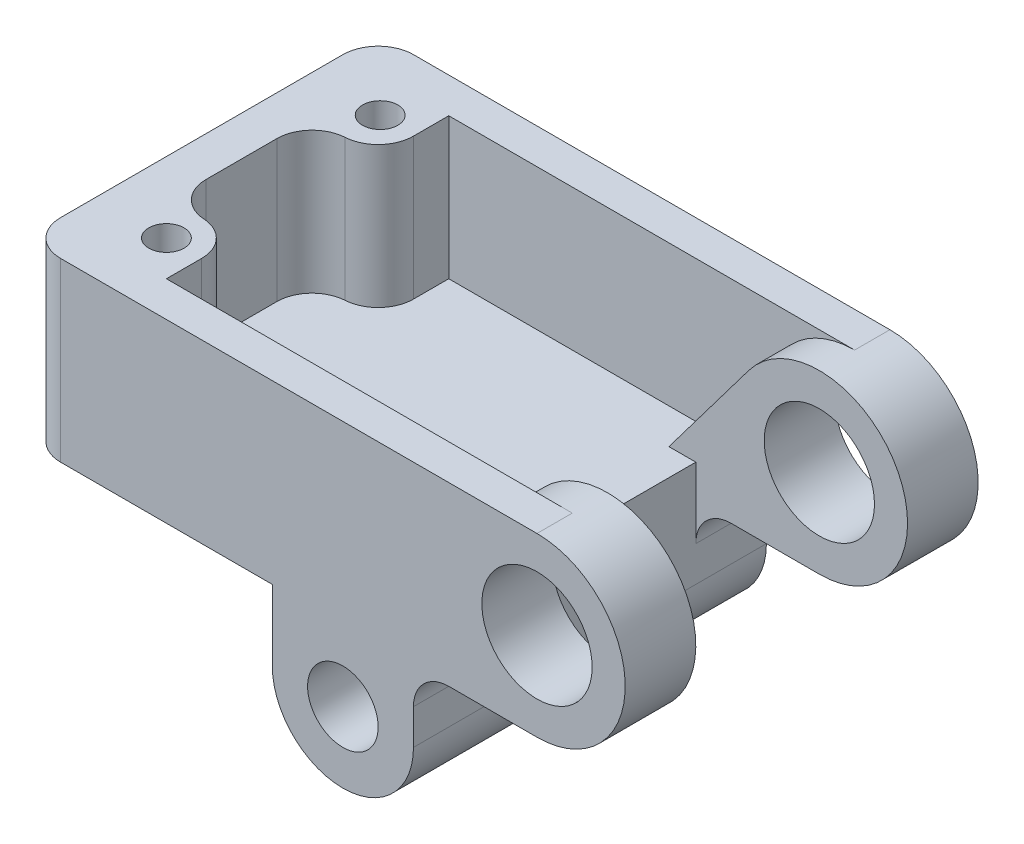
SolidWorks part; units mm, degrees
ref_plane "Front Plane" through (0, 0, 0) normal (0, 0, 1) x (1, 0, 0)
ref_plane "Top Plane" through (0, 0, 0) normal (0, 1, 0) x (1, 0, 0)
ref_plane "Right Plane" through (0, 0, 0) normal (1, 0, 0) x (0, 0, -1)
sketch "Sketch1" plane through (0, 0, 0) normal (0, 0, 1) x (1, 0, 0)
  line L0 (0, 40) -> (0, 0)
  line L1 (0, 0) -> (56, 0)
  line L2 (56, 0) -> (56, -16)
  line L3 (88, -16) -> (88, 0)
  line L4 (0, 40) -> (116, 40)
  line L5 (116, 0) -> (88, 0)
  arc A0 (56, -16) -> (88, -16) centre (72, -16) ccw
  arc A1 (116, 40) -> (116, 0) centre (116, 20) cw
  circle A2 centre (72, -16) radius 8
  circle A3 centre (116, 20) radius 12.5
  dimension "D5" = 16
  dimension "D6" = 16
  dimension "D7" = 25
  dimension "D1" = 72
  dimension "D2" = 40
  dimension "D3" = 16
  dimension "D4" = 44
extrude "Boss-Extrude1" add sketch "Sketch1" along normal mid plane 80
sketch "Sketch2" plane through (0, 40, 0) normal (0, 1, 0) x (1, 0, 0)
  line L0 (9, 8.0313) -> (9, -8.0313)
  line L2 (24, -24) -> (24, -32)
  line L3 (24, -32) -> (150.373, -32)
  line L4 (150.373, -32) -> (150.373, 32)
  line L5 (150.373, 32) -> (24, 32)
  line L6 (24, 32) -> (24, 24)
  line L8 (0, 0) -> (-24.6153, 0) construction
  line L9 (0, -40) -> (0, 40) construction
  line L10 (116, 40) -> (0, 40) construction
  arc A0 (24, 24) -> (16.5, 16.0156) centre (16, 24) cw
  arc A1 (16.5, -16.0156) -> (24, -24) centre (16, -24) cw
  arc A2 (9, -8.0313) -> (16.5, -16.0156) centre (17, -8.0313) ccw
  arc A3 (9, 8.0313) -> (16.5, 16.0156) centre (17, 8.0313) cw
  dimension "D1" = 8
  dimension "D2" = 9
  dimension "D3" = 16
  dimension "D4" = 16
  dimension "D5" = 8
extrude "Cut-Extrude1" cut sketch "Sketch2" against normal offset from surface (32 mm away) 8
sketch "Sketch5" plane through (0, 8, 0) normal (0, 1, 0) x (1, 0, 0)
  line L0 (88, -40) -> (88, 40) construction
  line L1 (88, 32) -> (158.1328, 32)
  line L2 (88, 32) -> (88, -32)
  line L3 (88, -32) -> (158.1328, -32)
  line L4 (158.1328, 32) -> (158.1328, -32)
  line L5 (116, 32) -> (24, 32) construction
  line L6 (24, -32) -> (116, -32) construction
  line L7 (0, -40) -> (0, 40) construction
  dimension "D1" = 88
  dimension "D2" = 64
extrude "Cut-Extrude2" cut sketch "Sketch5" against normal up to next
sketch "Sketch6" plane through (0, 0, -32) normal (0, 0, 1) x (1, 0, 0)
  line L0 (88, 0) -> (116, 0) construction
  line L2 (88, 0) -> (88, 8) construction
  line L3 (24, 8) -> (88, 8) construction
  line L5 (88, 0) -> (116, 0)
  line L6 (88, 0) -> (88, 8)
  line L7 (81.9146, 8) -> (88, 8)
  line L8 (81.9146, 8) -> (100.0273, 32.0363)
  arc A0 (116, 0) -> (116, 40) centre (116, 20) ccw construction
  circle A1 centre (116, 20) radius 12.5 construction
  arc A2 (116, 0) -> (116, 40) centre (116, 20) ccw
  circle A3 centre (116, 20) radius 12.5
  arc A4 (100.0273, 32.0363) -> (116, 40) centre (116, 20) cw
  dimension "D1" = 53
extrude "Boss-Extrude2" add sketch "Sketch6" along normal blind 8
mirror "Mirror1" about plane through (0, 0, 0) normal (0, 0, 1) of "Boss-Extrude2"
fillet "Fillet1" radius 8 4 edges at (0, 20, -40) (0, 20, 40) (88, 0, -32) (88, 0, 32)
hole_wizard "Ø8.0 (8) Diameter Hole1" positions "Sketch9" profile "Sketch10" hole size "Ø8.0" standard "Ansi Metric"
sketch "Sketch9" plane through (0, 40, 0) normal (0, 1, 0) x (-1, 0, 0)
  arc A0 (-24, 24) -> (-16.5, 16.0156) centre (-16, 24) ccw construction
  point P0 (-16.1059, -24.3493)
  point P1 (-16, 24)
sketch "Sketch10" plane through (16.1059, 40, -24.3493) normal (1, 0, 0) x (0, 0, 1)
  line L0 (0, 0) -> (0, 72)
  line L1 (0, 72) -> (4, 72)
  line L2 (4, 72) -> (4, 0)
  line L5 (4, 0) -> (0, 0)
  line L11 (0, -6.35) -> (0, 107.95) construction
  dimension "Thru Hole Dia." = 8
  dimension "Thru Hole Depth" = 72
sketch "Sketch11" plane through (0, 0, 0) normal (-1, 0, 0) x (0, 0, 1)
  line L0 (32, 0) -> (-32, 0) construction
  line L1 (-16, 0) -> (16, 0)
  line L2 (-16, 0) -> (-16, 16)
  line L4 (16, 0) -> (16, 16)
  arc A0 (-16, 16) -> (16, 16) centre (0, 16) cw
  circle A1 centre (0, 16) radius 4
  dimension "D1" = 16
  dimension "D3" = 8
  dimension "D2" = 16
extrude "Boss-Extrude3" add sketch "Sketch11" along normal blind 8
